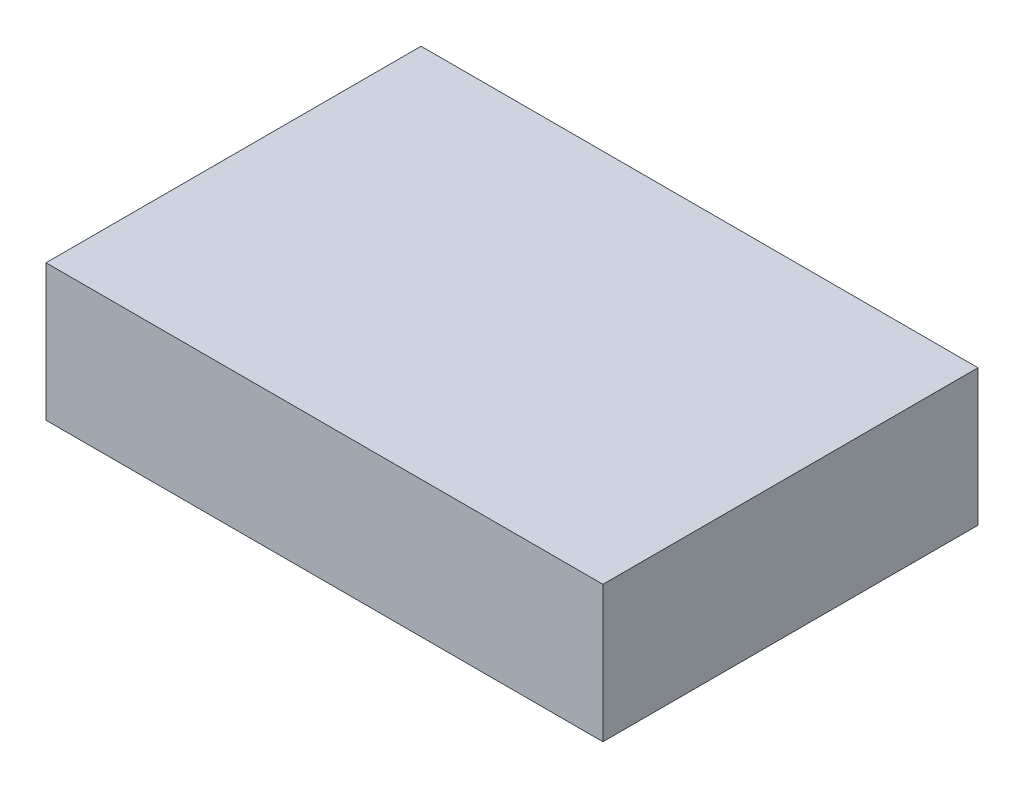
SolidWorks part; units mm, degrees
ref_plane "Front Plane" through (0, 0, 0) normal (0, 0, 1) x (1, 0, 0)
ref_plane "Top Plane" through (0, 0, 0) normal (0, 1, 0) x (1, 0, 0)
ref_plane "Right Plane" through (0, 0, 0) normal (1, 0, 0) x (0, 0, -1)
sketch "Sketch1" plane through (0, 0, 0) normal (0, 1, 0) x (1, 0, 0)
  line L1 (-24.5, 16.5) -> (24.5, 16.5)
  line L2 (-24.5, 16.5) -> (-24.5, -16.5)
  line L3 (-24.5, -16.5) -> (24.5, -16.5)
  line L4 (24.5, 16.5) -> (24.5, -16.5)
  line L5 (-24.5, 16.5) -> (24.5, -16.5) construction
  line L6 (-24.5, -16.5) -> (24.5, 16.5) construction
  point P0 (0, 0)
  dimension "D1" = 33
  dimension "D2" = 49
extrude "Boss-Extrude1" add sketch "Sketch1" along normal blind 12
